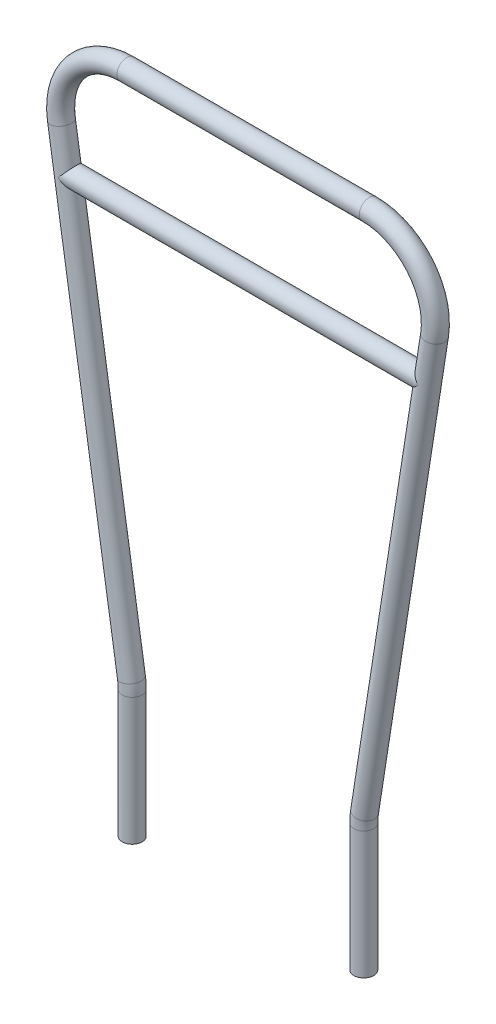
SolidWorks part; units mm, degrees
ref_plane "Plan1" through (0, 0, 0) normal (0, 0, 1) x (1, 0, 0)
ref_plane "Plan2" through (0, 0, 0) normal (0, 1, 0) x (1, 0, 0)
ref_plane "Plan3" through (0, 0, 0) normal (1, 0, 0) x (0, 0, -1)
sketch "Esquisse1" plane through (0, 0, 0) normal (0, 0, 1) x (1, 0, 0)
  line L0 (0, 0) -> (0, 192.2346)
  line L1 (-1.1988, 207.6723) -> (-106.9629, 884.5623)
  line L2 (-8.1617, 1000) -> (358.1617, 1000)
  line L3 (456.9629, 884.5623) -> (351.1988, 207.6723)
  line L4 (350, 192.2346) -> (350, 0)
  line L5 (350, 0) -> (0, 0) construction
  line L6 (350, 200) -> (0, 200) construction
  arc A0 (-8.1617, 1000) -> (-106.9629, 884.5623) centre (-8.1617, 900) ccw
  arc A1 (456.9629, 884.5623) -> (358.1617, 1000) centre (358.1617, 900) ccw
  arc A2 (-1.1988, 207.6723) -> (0, 192.2346) centre (-100, 192.2346) cw
  arc A3 (351.1988, 207.6723) -> (350, 192.2346) centre (450, 192.2346) ccw
  point P9 (-125, 1000)
  point P12 (475, 1000)
  dimension "D6" = 100
  dimension "D7" = 100
  dimension "D1" = 600
  dimension "D2" = 350
  dimension "D3" = 125
  dimension "D4" = 1000
  dimension "D5" = 200
sketch "Esquisse2" plane through (0, 0, 0) normal (0, 1, 0) x (1, 0, 0)
  circle A0 centre (0, 0) radius 15
  circle A1 centre (0, 0) radius 13
  dimension "D1" = 30
  dimension "D2" = 2
sweep "Balayage2" add profiles "Esquisse2" path "Esquisse1"
sketch "Esquisse3" plane through (0, 0, 0) normal (1, 0, 0) x (0, 0, -1)
  circle A0 centre (0, 820.8371) radius 15
  circle A1 centre (0, 820.8371) radius 13
  dimension "D1" = 30
  dimension "D2" = 2
extrude "Extrusion1" add sketch "Esquisse3" along normal up to next and the other way up to next
